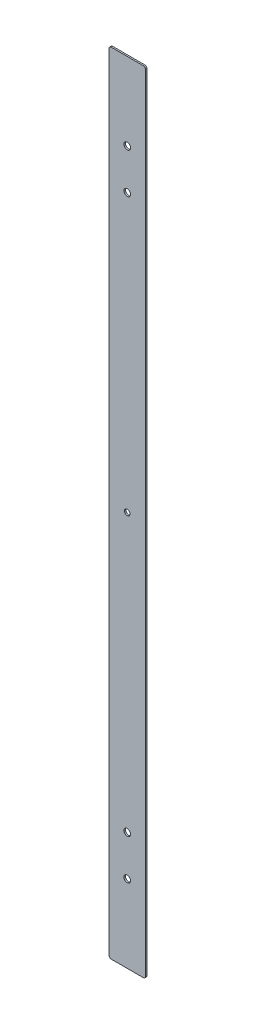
SolidWorks part; units mm, degrees
ref_plane "Ebene vorne" through (0, 0, 0) normal (0, 0, 1) x (1, 0, 0)
ref_plane "Ebene oben" through (0, 0, 0) normal (0, 1, 0) x (1, 0, 0)
ref_plane "Ebene rechts" through (0, 0, 0) normal (1, 0, 0) x (0, 0, -1)
sketch "Skizze1" plane through (0, 0, 0) normal (0, 0, 1) x (1, 0, 0)
  line L1 (-18, -392) -> (18, -392)
  line L2 (-18, -392) -> (-18, 392)
  line L3 (-18, 392) -> (18, 392)
  line L4 (18, -392) -> (18, 392)
  line L5 (-18, -392) -> (18, 392) construction
  line L6 (-18, 392) -> (18, -392) construction
  point P0 (0, 0)
  dimension "D1" = 784
  dimension "D2" = 36
extrude "Aufsatz-Linear austragen1" add sketch "Skizze1" along normal blind 1.5
hole_wizard "Durchgangsloch für M61" positions "Skizze4" profile "Skizze5" hole size "M6" standard "DIN"
sketch "Skizze4" plane through (0, 0, 1.5) normal (0, 0, 1) x (1, 0, 0)
  line L0 (0, 315) -> (0, 275) construction
  line L1 (0, 275) -> (0, 0) construction
  line L2 (0, 0) -> (0, -275) construction
  line L3 (0, -275) -> (0, -315) construction
  point P1 (0, 315)
  point P2 (0, 275)
  point P7 (0, -275)
  point P9 (0, -315)
  dimension "D1" = 550
  dimension "D2" = 40
sketch "Skizze5" plane through (0, 315, 1.5) normal (1, 0, 0) x (0, -1, 0)
  line L0 (0, 0) -> (0, 1.5)
  line L1 (0, 1.5) -> (3.3, 1.5)
  line L2 (3.3, 1.5) -> (3.3, 0)
  line L5 (3.3, 0) -> (0, 0)
  line L11 (0, -6.35) -> (0, 107.95) construction
  dimension "Bohrerdurchmesser" = 6.6
  dimension "Bohrungstiefe" = 1.5
sketch "Skizze6" plane through (0, 0, 1.5) normal (0, 0, 1) x (1, 0, 0)
  line L0 (18, -392) -> (18, 392) construction
  line L1 (-18, 392) -> (18, 392)
  line L2 (-18, 392) -> (-18, 372)
  line L3 (-18, 372) -> (18, 372)
  line L4 (18, 392) -> (18, 372)
  dimension "D1" = 20
extrude "Schnitt-Linear austragen1" [suppressed] cut sketch "Skizze6" against normal through all
fillet "Verrundung1" radius 2 4 edges at (-18, -392, 0.75) (18, -392, 0.75) (-18, 392, 0.75) (18, 392, 0.75)
hole_wizard "Durchgangsloch für M51" positions "Skizze7" profile "Skizze8" hole size "M5" standard "DIN"
sketch "Skizze7" plane through (0, 0, 1.5) normal (0, 0, 1) x (1, 0, 0)
  point P0 (0, 0)
sketch "Skizze8" plane through (0, 0, 1.5) normal (1, 0, 0) x (0, -1, 0)
  line L0 (0, 0) -> (0, 1.5)
  line L1 (0, 1.5) -> (2.75, 1.5)
  line L2 (2.75, 1.5) -> (2.75, 0)
  line L5 (2.75, 0) -> (0, 0)
  line L11 (0, -6.35) -> (0, 107.95) construction
  dimension "Bohrerdurchmesser" = 5.5
  dimension "Bohrungstiefe" = 1.5
